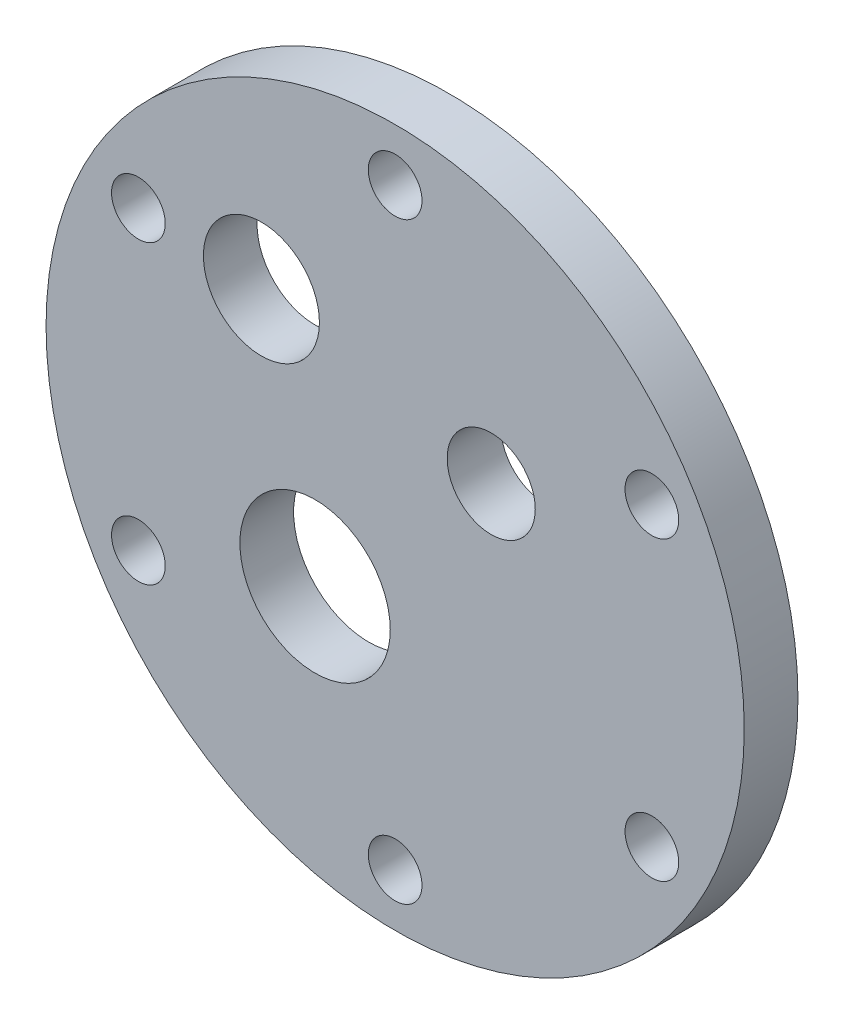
SolidWorks part; units mm, degrees
ref_plane "Front Plane" through (0, 0, 0) normal (0, 0, 1) x (1, 0, 0)
ref_plane "Top Plane" through (0, 0, 0) normal (0, 1, 0) x (1, 0, 0)
ref_plane "Right Plane" through (0, 0, 0) normal (1, 0, 0) x (0, 0, -1)
sketch "Sketch1" plane through (0, 0, 0) normal (0, 0, 1) x (1, 0, 0)
  circle A0 centre (0, 0) radius 41.275
  dimension "D1" = 82.55
extrude "Boss-Extrude1" add sketch "Sketch1" along normal blind 6.35
sketch "Sketch2" plane through (0, 0, 0) normal (0, 0, 1) x (1, 0, 0)
  circle A1 centre (0, 35.052) radius 3.175
  dimension "D1" = 6.35
  dimension "D2" = 35.052
extrude "Cut-Extrude2" cut sketch "Sketch2" along normal through all
pattern_circular "CirPattern2" count 6 over 360 about axis through (0, 0, 0) along (0, 0, 1) of "Cut-Extrude2"
sketch "Sketch4" plane through (0, 0, 6.35) normal (0, 0, 1) x (1, 0, 0)
  circle A0 centre (-15.8114, 16.51) radius 6.858
  dimension "D1" = 13.716
  dimension "D3" = 22.86
  dimension "D2" = 16.51
extrude "Cut-Extrude4" cut sketch "Sketch4" against normal through all
sketch "Sketch5" plane through (0, 0, 6.35) normal (0, 0, 1) x (1, 0, 0)
  circle A0 centre (-9.4684, -10.7596) radius 8.89
  dimension "D1" = 17.78
  dimension "D3" = 9.4684
  dimension "D2" = 14.3325
extrude "Cut-Extrude5" cut sketch "Sketch5" against normal through all
sketch "Sketch6" plane through (0, 0, 6.35) normal (0, 0, 1) x (1, 0, 0)
  circle A0 centre (11.3592, 10.16) radius 5.207
  dimension "D1" = 10.414
  dimension "D3" = 15.24
  dimension "D2" = 10.16
extrude "Cut-Extrude6" cut sketch "Sketch6" against normal through all
